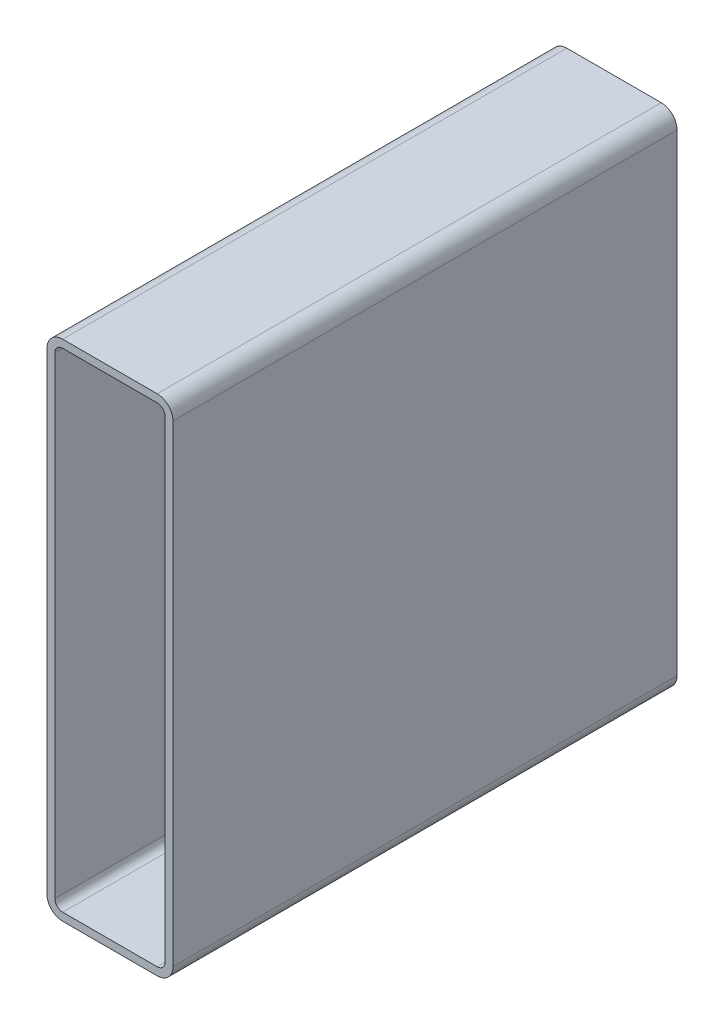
SolidWorks part; units mm, degrees
ref_plane "Front Plane" through (0, 0, 0) normal (0, 0, 1) x (1, 0, 0)
ref_plane "Top Plane" through (0, 0, 0) normal (0, 1, 0) x (1, 0, 0)
ref_plane "Right Plane" through (0, 0, 0) normal (1, 0, 0) x (0, 0, -1)
sketch "Sketch1" plane through (0, 0, 0) normal (0, 0, 1) x (1, 0, 0)
sketch_block_instance "HSS12x3x0.1875-1"
sketch_block "HSS12x3x0.1875"
extrude "Boss-Extrude1" add sketch "Sketch1" along normal blind 304.8
